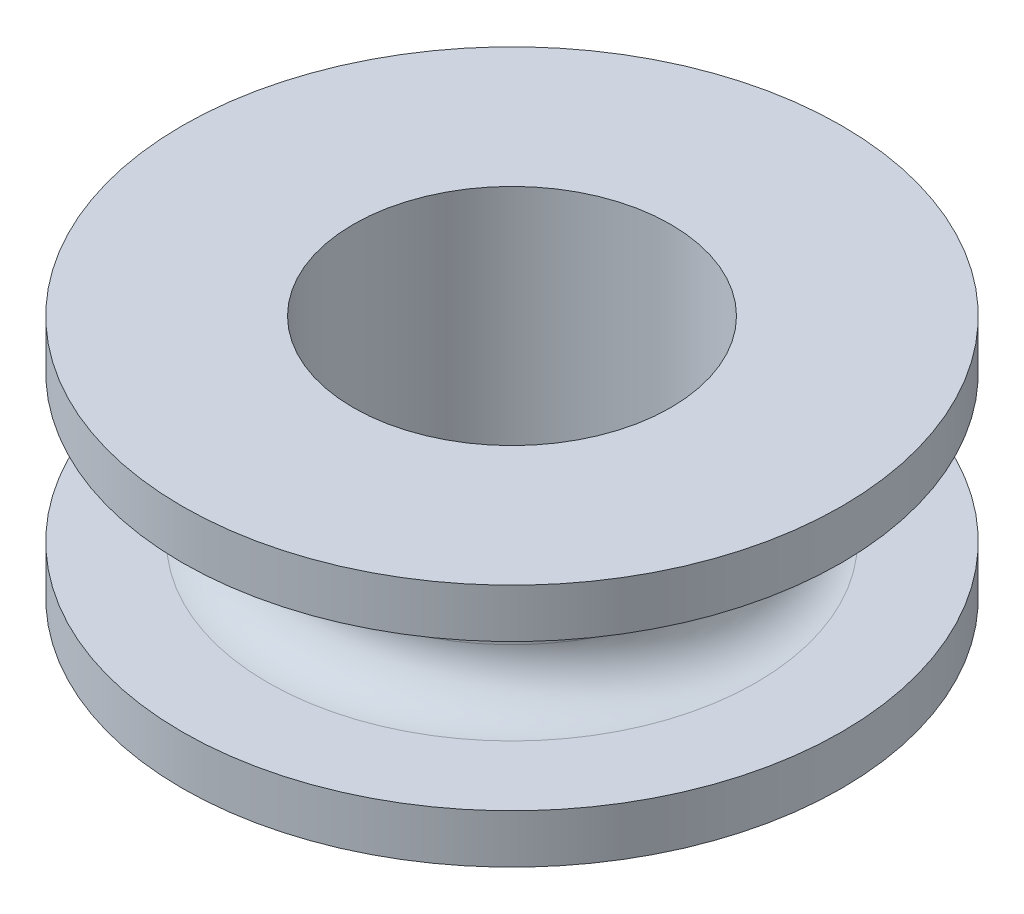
SolidWorks part; units mm, degrees
ref_plane "Front Plane" through (0, 0, 0) normal (0, 0, 1) x (1, 0, 0)
ref_plane "Top Plane" through (0, 0, 0) normal (0, 1, 0) x (1, 0, 0)
ref_plane "Right Plane" through (0, 0, 0) normal (1, 0, 0) x (0, 0, -1)
sketch "Sketch1" plane through (0, 0, 0) normal (0, 1, 0) x (1, 0, 0)
  circle A0 centre (0, 0) radius 6.5
  circle A1 centre (0, 0) radius 8
  dimension "D1" = 13
  dimension "D2" = 16
extrude "Boss-Extrude1" add sketch "Sketch1" along normal blind 10
sketch "Sketch2" plane through (0, 0, 0) normal (0, 0, 1) x (1, 0, 0)
  line L1 (8, 0) -> (13.5, 0)
  line L2 (8, 0) -> (8, 2)
  line L3 (8, 2) -> (13.5, 2)
  line L4 (13.5, 0) -> (13.5, 2)
  line L5 (8, 10) -> (13.5, 10)
  line L6 (8, 10) -> (8, 8)
  line L7 (8, 8) -> (13.5, 8)
  line L8 (13.5, 10) -> (13.5, 8)
  dimension "D1" = 5.5
  dimension "D2" = 2
revolve "Revolve1" add sketch "Sketch2" angle 360 about axis through (0, 10, 0) along (0, -1, 0)
fillet "Fillet1" radius 2 2 edges at (0, 8, 8) (0, 2, -8)
